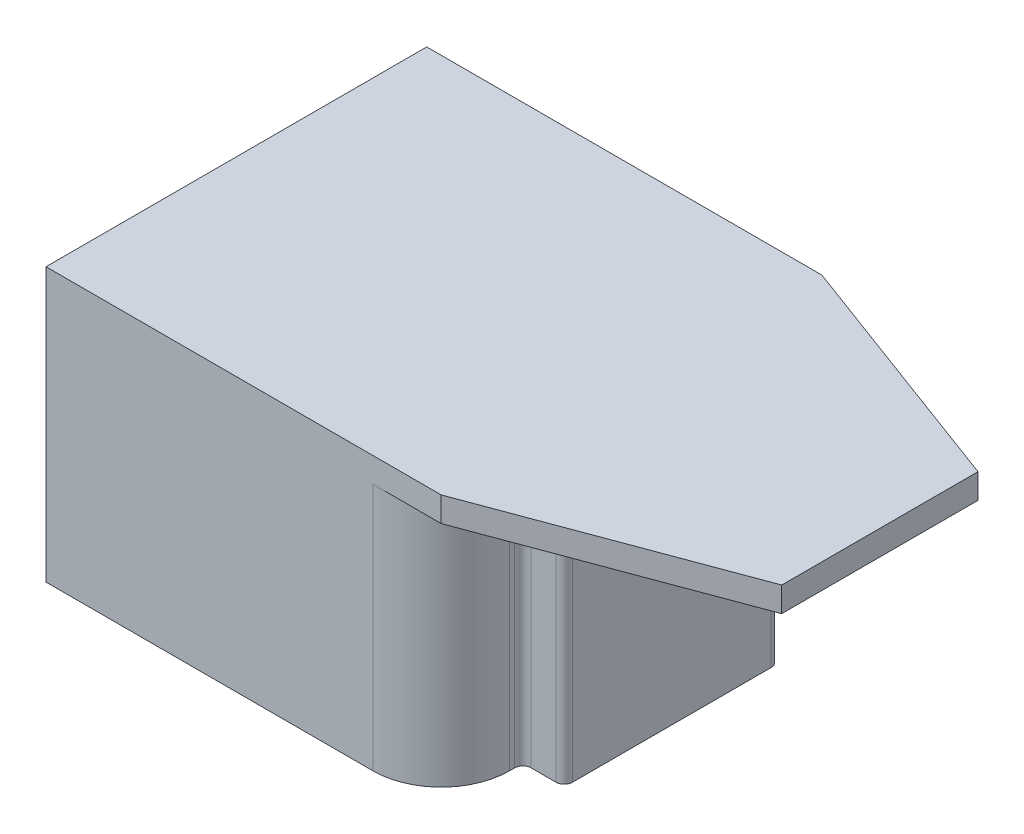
SolidWorks part; units mm, degrees
ref_plane "Alzado" through (0, 0, 0) normal (0, 0, 1) x (1, 0, 0)
ref_plane "Planta" through (0, 0, 0) normal (0, 1, 0) x (1, 0, 0)
ref_plane "Vista lateral" through (0, 0, 0) normal (1, 0, 0) x (0, 0, -1)
sketch "Croquis1" plane through (0, 0, 0) normal (0, 1, 0) x (1, 0, 0)
  line L12 (-39.5, 46) -> (39.5139, 46)
  line L13 (56, 28.8233) -> (56, 27.7301)
  line L14 (39.5, -46) -> (-39.5, -46)
  line L16 (-39.5, -46) -> (-39.5, -40)
  line L17 (-39.5, 40) -> (-39.5, 46)
  line L19 (50, -0.2699) -> (143.2716, -0.2699) construction
  line L20 (39.5, -40) -> (-39.5, -40)
  line L21 (132.78, -20.2699) -> (30.5649, -20.2699) construction
  line L23 (50, -29.5) -> (50, -20.2699)
  line L24 (132.78, 19.7301) -> (94.3511, 19.7301) construction
  line L25 (50, 19.7301) -> (50, -20.2699) construction
  line L26 (50, -20.2699) -> (60, -20.2699) construction
  line L27 (60, -20.2699) -> (60, 19.7301) construction
  line L28 (60, 19.7301) -> (50, 19.7301) construction
  line L29 (96.8866, 25.7301) -> (25.2245, 25.7301) construction
  line L30 (96.8866, -26.2699) -> (25.2245, -26.2699) construction
  line L31 (66, -30.1767) -> (66, 41.9813) construction
  line L32 (58, 25.7301) -> (64, 25.7301)
  line L33 (66, 23.7301) -> (66, -24.2699)
  line L34 (64, -26.2699) -> (58, -26.2699)
  line L35 (50, -20.2699) -> (60, -20.2699)
  line L36 (-39.5, -40) -> (39.5, -40)
  line L37 (60, -20.2699) -> (60, 19.7301)
  line L38 (60, 19.7301) -> (50, 19.7301)
  line L39 (50, 19.7301) -> (50, 28.9603)
  line L40 (56, -28.2699) -> (56, -29.5)
  line L41 (-39.5, 40) -> (39.5139, 40)
  line L42 (50, -20.2699) -> (50, -29.5)
  line L43 (50, 28.9603) -> (50, 19.7301)
  arc A0 (50, 28.9603) -> (39.5139, 40) centre (39.5139, 29.5) ccw
  arc A15 (50, -29.5) -> (39.5, -40) centre (39.5, -29.5) cw
  arc A20 (58, -26.2699) -> (56, -28.2699) centre (58, -28.2699) ccw
  arc A23 (56, 28.8233) -> (39.5139, 46) centre (39.5139, 29.5) ccw
  arc A24 (39.5, -46) -> (56, -29.5) centre (39.5, -29.5) ccw
  arc A25 (66, -24.2699) -> (64, -26.2699) centre (64, -24.2699) cw
  arc A26 (58, 25.7301) -> (56, 27.7301) centre (58, 27.7301) cw
  arc A27 (64, 25.7301) -> (66, 23.7301) centre (64, 23.7301) cw
  point P30 (56, -26.2699)
  point P35 (66, -26.2699)
  point P38 (56, 25.7301)
  point P41 (66, 25.7301)
  dimension "D8" = 10.5
  dimension "D9" = 16.5
  dimension "D12" = 20
  dimension "D2" = 6
  dimension "D6" = 16.5
  dimension "D7" = 10.5
  dimension "D15" = 6
  dimension "D16" = 2
  dimension "D1" = 6
  dimension "D3" = 92
  dimension "D4" = 6
  dimension "D5" = 95.5
  dimension "D10" = 40
  dimension "D11" = 50
  dimension "D13" = 10
  dimension "D14" = 6
extrude "Saliente-Extruir1" add sketch "Croquis1" along normal blind 60 contours L14 A24 L13 A23 L12 L17 L41 A0 L23 A15 L20 L16
sketch "Croquis2" plane through (0, 60, 0) normal (0, 1, 0) x (1, 0, 0)
  line L0 (-39.5, 46) -> (-39.5, -46)
  line L1 (-39.5, -46) -> (56, -46)
  line L3 (56, 46) -> (-39.5, 46)
  line L4 (116, 23.7143) -> (116, -23.7143)
  line L5 (126, -77.525) -> (126, -20) construction
  line L6 (56, 0) -> (126, 0) construction
  line L7 (172.6391, 20) -> (126, 20) construction
  line L8 (172.6391, -20) -> (126, -20) construction
  line L9 (56, 46) -> (116, 23.7143)
  line L11 (116, -23.7143) -> (56, -46)
  line L12 (116, 20) -> (98.8111, 20) construction
  line L13 (126, 20) -> (126, 89.7791) construction
  line L14 (116, -20) -> (98.8111, -20) construction
  dimension "D1" = 10
  dimension "D2" = 20
extrude "Saliente-Extruir2" add sketch "Croquis2" along normal blind 6
sketch "Croquis3" plane through (60, 0, 0) normal (-1, 0, 0) x (0, 0, 1)
  line L0 (20.2699, 60) -> (20.2699, 0) construction
  line L1 (-19.7301, 60) -> (20.2699, 60)
  line L2 (-19.7301, 60) -> (-19.7301, 50)
  line L3 (-19.7301, 50) -> (20.2699, 50)
  line L4 (20.2699, 60) -> (20.2699, 50)
  dimension "D1" = 10
extrude "Cortar-Extruir1" cut sketch "Croquis3" against normal through all
